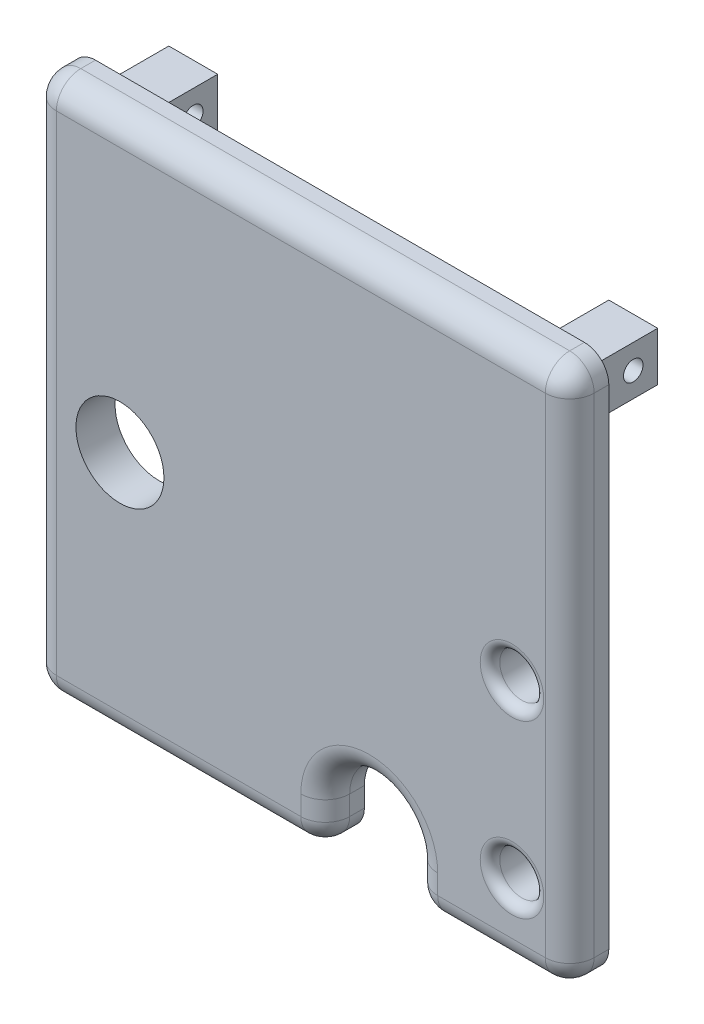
SolidWorks part; units mm, degrees
ref_plane "Front Plane" through (0, 0, 0) normal (0, 0, 1) x (1, 0, 0)
ref_plane "Top Plane" through (0, 0, 0) normal (0, 1, 0) x (1, 0, 0)
ref_plane "Right Plane" through (0, 0, 0) normal (1, 0, 0) x (0, 0, -1)
sketch "Sketch1" plane through (0, 0, 0) normal (0, 0, 1) x (1, 0, 0)
  line L1 (-55, -55) -> (55, -55)
  line L2 (-55, -55) -> (-55, 55)
  line L3 (-55, 55) -> (55, 55)
  line L4 (55, -55) -> (55, 55)
  line L5 (-55, -55) -> (55, 55) construction
  line L6 (-55, 55) -> (55, -55) construction
  point P0 (0, 0)
  dimension "D1" = 110
  dimension "D2" = 110
extrude "Boss-Extrude1" add sketch "Sketch1" along normal blind 8
sketch "Sketch10" plane through (0, 0, 0) normal (0, 0, -1) x (-1, 0, 0)
  line L0 (-55, 55) -> (-50, 55) construction
  line L1 (-55, 55) -> (55, 55) construction
  line L2 (-50, 55) -> (-50, 50) construction
  line L4 (-50, 50) -> (-40, 50)
  line L5 (-50, 50) -> (-50, 40)
  line L6 (-50, 40) -> (-40, 40)
  line L7 (-40, 50) -> (-40, 40)
  line L8 (0, 12.65) -> (0, -12.65) construction
  line L9 (50, 50) -> (50, 40)
  line L10 (50, 50) -> (40, 50)
  line L11 (40, 50) -> (40, 40)
  line L12 (50, 40) -> (40, 40)
  line L13 (12.65, 0) -> (-12.65, 0) construction
  line L14 (50, -50) -> (40, -50)
  line L15 (40, -50) -> (40, -40)
  line L16 (50, -40) -> (40, -40)
  line L17 (50, -50) -> (50, -40)
  line L18 (-50, -50) -> (-50, -40)
  line L19 (-50, -50) -> (-40, -50)
  line L20 (-40, -50) -> (-40, -40)
  line L21 (-50, -40) -> (-40, -40)
  dimension "D1" = 5
  dimension "D2" = 5
  dimension "D3" = 10
  dimension "D4" = 10
extrude "Boss-Extrude2" add sketch "Sketch10" along normal blind 15
sketch "Sketch9" plane through (0, 0, 8) normal (0, 0, 1) x (1, 0, 0)
  line L0 (0, 0) -> (0, -55) construction
  line L1 (-55, -55) -> (55, -55) construction
  line L2 (0, -55) -> (55, -55) construction
  line L3 (55, -55) -> (55, 55) construction
  line L4 (5, -46) -> (5, -55)
  line L5 (23, -46) -> (23, -55)
  line L6 (23, -55) -> (5, -55)
  line L7 (-55, 55) -> (-55, -55) construction
  arc A0 (23, -46) -> (5, -46) centre (14, -46) ccw
  circle A1 centre (43.2, -39.3) radius 4.5
  circle A2 centre (43.2, -4.3) radius 4.5
  circle A3 centre (-37, -4) radius 9
  dimension "D2" = 9
  dimension "D3" = 18
  dimension "D8" = 18
  dimension "D9" = 51
  dimension "D1" = 35
  dimension "D4" = 15.7
  dimension "D5" = 11.8
  dimension "D6" = 41
  dimension "D7" = 9
  dimension "D10" = 18
extrude "Cut-Extrude2" cut sketch "Sketch9" against normal through all
fillet "Fillet4" radius 5 3 edges at (5, -50.5, 8) (14, -37, 8) (23, -50.5, 8)
fillet "Fillet5" radius 2 2 edges at (47.7, -4.3, 8) (47.7, -39.3, 8)
fillet "Fillet6" radius 5 9 edges at (23, -55, 1.5) (24.4645, -55, 6.5355) (5, -55, 1.5) (3.5355, -55, 6.5355) (41.5, -55, 8) (55, 0, 8) (0, 55, 8) (-55, 0, 8) (-27.5, -55, 8)
fillet "Fillet7" radius 5 8 edges at (-55, -55, 1.5) (-55, 55, 1.5) (55, 55, 1.5) (55, -55, 1.5) (-53.5355, -53.5355, 6.5355) (-53.5355, 53.5355, 6.5355) (53.5355, 53.5355, 6.5355) (53.5355, -53.5355, 6.5355)
sketch "Sketch12" plane through (50, 0, 0) normal (1, 0, 0) x (0, 0, -1)
  line L0 (15, 50) -> (15, 40) construction
  line L1 (15, 50) -> (0, 50) construction
  line L2 (15, -40) -> (0, -40) construction
  circle A0 centre (10, 45) radius 2
  circle A1 centre (10, -45) radius 2
  dimension "D1" = 4
  dimension "D2" = 5
  dimension "D3" = 5
  dimension "D4" = 5
extrude "Cut-Extrude4" cut sketch "Sketch12" against normal through all
sketch "Sketch13" plane through (0, 0, -15) normal (0, 0, -1) x (-1, 0, 0)
  line L4 (-47.6452, -40) -> (-50, -40)
  line L5 (-50, -40) -> (-50, -50)
  line L6 (-50, -50) -> (-40, -50)
  line L7 (-40, -50) -> (-40, -42.4639)
  line L8 (-47.6452, -40) -> (-50, -40)
  line L9 (-50, -40) -> (-50, -50)
  line L10 (-50, -50) -> (-40, -50)
  line L11 (-40, -50) -> (-40, -42.4639)
  arc A1 (-47.6452, -40) -> (-40, -42.4639) centre (-43.2, -39.3) ccw
  arc A2 (-47.6452, -40) -> (-40, -42.4639) centre (-43.2, -39.3) ccw
  dimension "D1" = 0
extrude "Cut-Extrude5" cut sketch "Sketch13" against normal up to surface (15 mm away)
